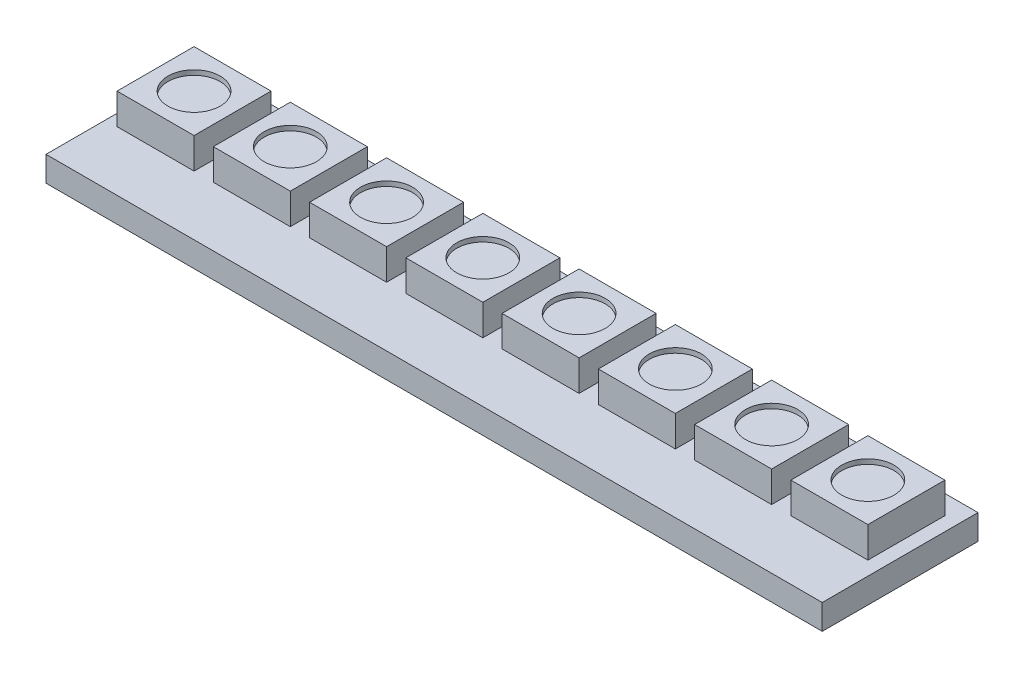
SolidWorks part; units mm, degrees
ref_plane "Front Plane" through (0, 0, 0) normal (0, 0, 1) x (1, 0, 0)
ref_plane "Top Plane" through (0, 0, 0) normal (0, 1, 0) x (1, 0, 0)
ref_plane "Right Plane" through (0, 0, 0) normal (1, 0, 0) x (0, 0, -1)
sketch "Sketch1" plane through (0, 0, 0) normal (0, 1, 0) x (1, 0, 0)
  line L1 (25.6032, -5.1371) -> (-25.6032, -5.1372)
  line L2 (25.6032, -5.1371) -> (25.6032, 5.1372)
  line L3 (25.6032, 5.1372) -> (-25.6032, 5.1371)
  line L4 (-25.6032, -5.1372) -> (-25.6032, 5.1371)
  line L5 (25.6032, -5.1371) -> (-25.6032, 5.1371) construction
  line L6 (25.6032, 5.1372) -> (-25.6032, -5.1372) construction
  point P0 (0, 0)
  dimension "D1" = 10.2743
  dimension "D2" = 51.2064
extrude "Boss-Extrude1" add sketch "Sketch1" along normal blind 1.651
sketch "Sketch2" plane through (0, 1.651, 0) normal (0, 1, 0) x (1, 0, 0)
  line L0 (25.6032, 5.1372) -> (-25.6032, 5.1371) construction
  line L1 (-25.6032, 5.1371) -> (-25.6032, -5.1372) construction
  line L2 (-24.8412, -1.2128) -> (-19.7612, -1.2128)
  line L3 (-24.8412, -1.2128) -> (-24.8412, 3.8672)
  line L4 (-24.8412, 3.8672) -> (-19.7612, 3.8672)
  line L5 (-19.7612, -1.2128) -> (-19.7612, 3.8672)
  line L6 (-24.8412, -1.2128) -> (-19.7612, 3.8672) construction
  line L7 (-24.8412, 3.8672) -> (-19.7612, -1.2128) construction
  point P7 (-22.3012, 1.3272)
  dimension "D1" = 5.08
  dimension "D2" = 1.27
  dimension "D3" = 0.762
extrude "Boss-Extrude2" add sketch "Sketch2" along normal blind 2.032
sketch "Sketch3" plane through (0, 3.683, 0) normal (0, 1, 0) x (1, 0, 0)
  line L0 (-24.8412, 3.8672) -> (-19.7612, -1.2128) construction
  circle A0 centre (-22.3012, 1.3272) radius 1.7218
  dimension "D1" = 3.4436
extrude "Cut-Extrude1" cut sketch "Sketch3" against normal blind 0.3175
pattern_linear "LPattern1" count 8 spacing 6.35 along (1, 0, 0) of "Boss-Extrude2", "Cut-Extrude1"
